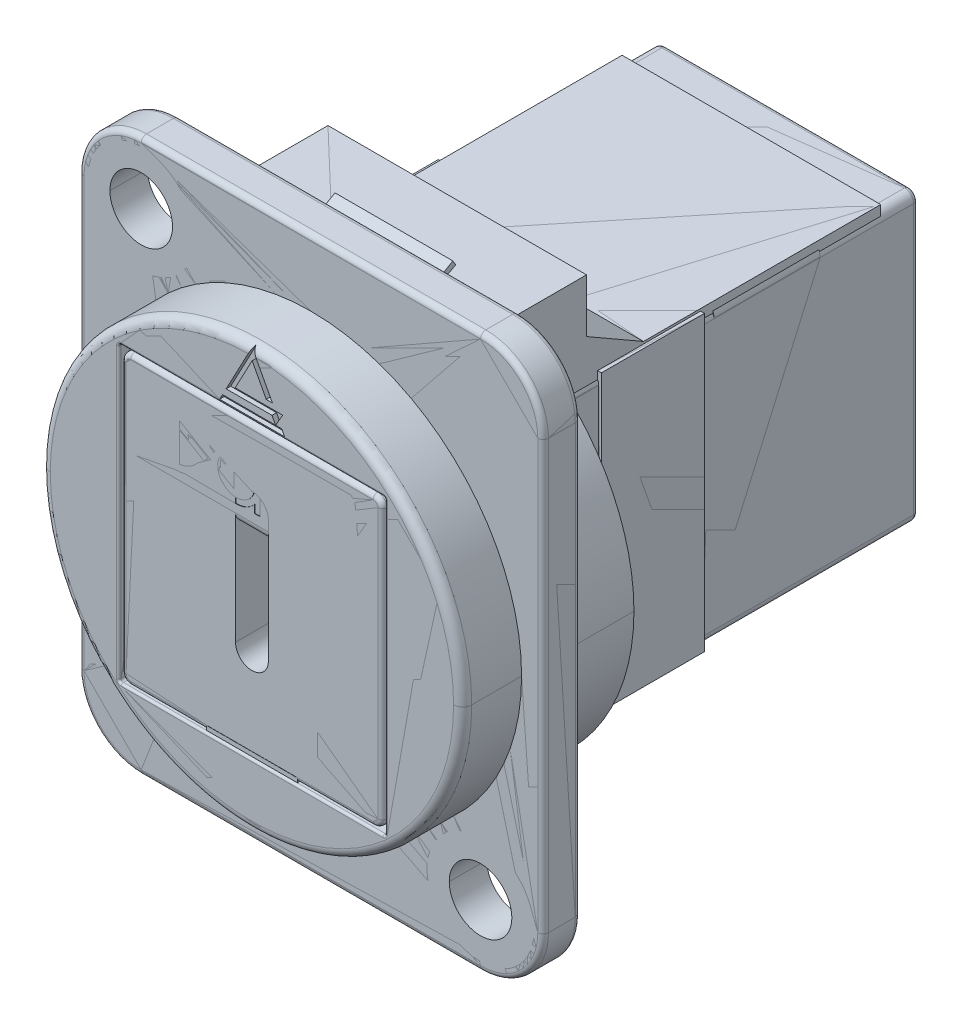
SolidWorks part; units mm, degrees
ref_plane "Front Plane" through (0, 0, 0) normal (0, 0, 1) x (1, 0, 0)
ref_plane "Top Plane" through (0, 0, 0) normal (0, 1, 0) x (1, 0, 0)
ref_plane "Right Plane" through (0, 0, 0) normal (1, 0, 0) x (0, 0, -1)
imported_body "EHRJ45D6S.STEP<1>"
sketch "Sketch1" plane through (0, 0, 3.3) normal (0, 0, 1) x (1, 0, 0)
  line L16 (2.54, -7.8994) -> (6.7945, -7.8994)
  line L17 (7.0485, -7.6454) -> (7.0485, 7.4422)
  line L18 (6.7945, 7.6962) -> (-6.7945, 7.6962)
  line L19 (-7.0485, 7.4422) -> (-7.0485, -7.6454)
  line L20 (-6.7945, -7.8994) -> (-2.54, -7.8994)
  line L21 (-2.54, -7.8994) -> (-2.54, -6.35)
  line L22 (-2.54, -6.35) -> (-3.6576, -6.35)
  line L23 (-3.6576, -6.35) -> (-3.6576, -4.6736)
  line L24 (-3.6576, -4.6736) -> (-6.5024, -4.6736)
  line L25 (-6.5024, -4.6736) -> (-6.5024, 3.2004)
  line L26 (-6.5024, 3.2004) -> (6.5024, 3.2004)
  line L27 (6.5024, 3.2004) -> (6.5024, -4.6736)
  line L28 (6.5024, -4.6736) -> (3.6576, -4.6736)
  line L29 (3.6576, -4.6736) -> (3.6576, -6.35)
  line L30 (3.6576, -6.35) -> (2.54, -6.35)
  line L31 (2.54, -6.35) -> (2.54, -7.8994)
  line L33 (7.0485, -7.6454) -> (7.0485, 7.4422)
  line L34 (6.7945, 7.6962) -> (-6.7945, 7.6962)
  line L35 (-7.0485, 7.4422) -> (-7.0485, -7.6454)
  line L36 (-6.7945, -7.8994) -> (6.7945, -7.8994)
  arc A4 (6.7945, -7.8994) -> (7.0485, -7.6454) centre (6.7945, -7.6454) ccw
  arc A5 (7.0485, 7.4422) -> (6.7945, 7.6962) centre (6.7945, 7.4422) ccw
  arc A6 (-6.7945, 7.6962) -> (-7.0485, 7.4422) centre (-6.7945, 7.4422) ccw
  arc A7 (-7.0485, -7.6454) -> (-6.7945, -7.8994) centre (-6.7945, -7.6454) ccw
  arc A8 (6.7945, -7.8994) -> (7.0485, -7.6454) centre (6.7945, -7.6454) ccw
  arc A9 (7.0485, 7.4422) -> (6.7945, 7.6962) centre (6.7945, 7.4422) ccw
  arc A10 (-6.7945, 7.6962) -> (-7.0485, 7.4422) centre (-6.7945, 7.4422) ccw
  arc A11 (-7.0485, -7.6454) -> (-6.7945, -7.8994) centre (-6.7945, -7.6454) ccw
  dimension "D1" = 0
extrude "Boss-Extrude1" add sketch "Sketch1" against normal up to surface (29.9974 mm away)
sketch "Sketch2" plane through (0, 0, 3.3) normal (0, 0, 1) x (1, 0, 0)
  line L0 (0, 3.7889) -> (0, -3.062) construction
  line L1 (0.9188, 3.7889) -> (0.9188, -3.062)
  line L2 (-0.9188, 3.7889) -> (-0.9188, -3.062)
  arc A0 (0.9188, 3.7889) -> (-0.9188, 3.7889) centre (0, 3.7889) ccw
  arc A1 (-0.9188, -3.062) -> (0.9188, -3.062) centre (0, -3.062) ccw
  point P3 (0, 0.3634)
extrude "Cut-Extrude1" cut sketch "Sketch2" against normal blind 5
sketch "Sketch3" plane through (0, 0, -26.6974) normal (0, 0, -1) x (-1, 0, 0)
  line L2 (-0.9188, 3.7889) -> (-0.9188, -3.062)
  line L3 (0.9188, -3.062) -> (0.9188, 3.7889)
  line L4 (-0.9188, 3.7889) -> (-0.9188, -3.062)
  line L5 (0.9188, -3.062) -> (0.9188, 3.7889)
  arc A2 (-0.9188, -3.062) -> (0.9188, -3.062) centre (0, -3.062) ccw
  arc A3 (0.9188, 3.7889) -> (-0.9188, 3.7889) centre (0, 3.7889) ccw
  arc A4 (-0.9188, -3.062) -> (0.9188, -3.062) centre (0, -3.062) ccw
  arc A5 (0.9188, 3.7889) -> (-0.9188, 3.7889) centre (0, 3.7889) ccw
  dimension "D1" = 0
extrude "Cut-Extrude2" cut sketch "Sketch3" against normal blind 5
sketch "Sketch4" plane through (0, 0, -2.1) normal (0, 0, -1) x (-1, 0, 0)
  line L0 (-9.4996, -15.194) -> (9.4996, -15.194) construction
  line L1 (-6.5035, -12.0763) -> (10.9324, -12.0763)
  line L2 (-6.5035, -12.0763) -> (-6.5035, -15.194)
  line L4 (10.9324, -12.0763) -> (10.9324, -14.8559)
  line L5 (-6.5035, -12.0763) -> (6.0979, -15.194) construction
  line L6 (-1.6689, -15.194) -> (10.9324, -12.0763) construction
  line L7 (-6.5035, -15.194) -> (9.4996, -15.194)
  arc A0 (9.4996, -15.194) -> (12.7048, -11.9888) centre (9.4996, -11.9888) ccw construction
  arc A1 (9.4996, -15.194) -> (10.9324, -14.8559) centre (9.4996, -11.9888) ccw
  point P4 (2.2145, -14.2332)
extrude "Boss-Extrude2" add sketch "Sketch4" against normal up to surface (0.3048 mm away)
hole_wizard "CSK for #4 Flat Head Machine Screw1" positions "Sketch5" profile "Sketch6" countersink size "#4" standard "ANSI Inch"
sketch "Sketch5" plane through (0, 0, 0) normal (0, 0, 1) x (1, 0, 0)
  point P0 (-9.4996, 12.0142)
  point P3 (9.4996, -11.9888)
sketch "Sketch6" plane through (-9.4996, 12.0142, 0) normal (1, 0, 0) x (0, -1, 0)
  line L0 (0, 0) -> (0, 26.6974)
  line L1 (0, 26.6974) -> (1.7272, 26.6974)
  line L2 (1.7272, 26.6974) -> (1.7272, 1.461)
  line L3 (1.7272, 1.461) -> (2.9972, 0)
  line L5 (2.9972, 0) -> (0, 0)
  line L6 (-1.7272, 1.461) -> (-2.9972, 0) construction
  line L11 (0, -6.35) -> (0, 107.95) construction
  dimension "Thru Hole Dia." = 3.4544
  dimension "Thru Hole Depth" = 26.6974
  dimension "Near C'Sink Dia." = 5.9944
  dimension "Near C'Sink Angle" = 82
